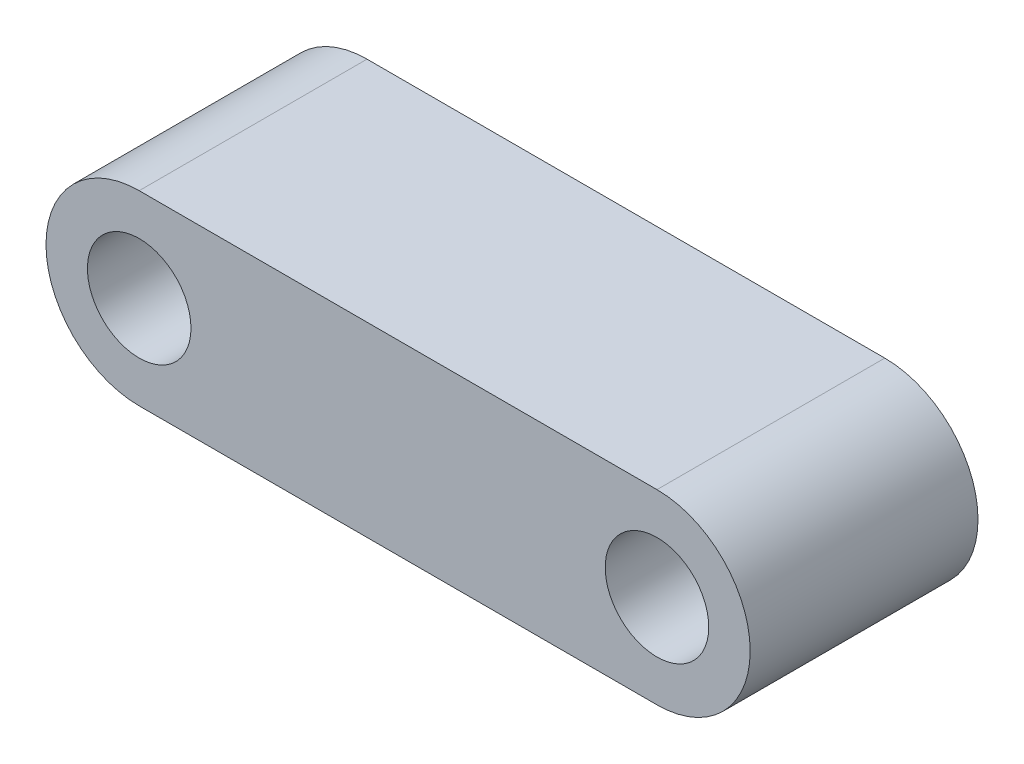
SolidWorks part; units mm, degrees
ref_plane "Alzado" through (0, 0, 0) normal (0, 0, 1) x (1, 0, 0)
ref_plane "Planta" through (0, 0, 0) normal (0, 1, 0) x (1, 0, 0)
ref_plane "Vista lateral" through (0, 0, 0) normal (1, 0, 0) x (0, 0, -1)
sketch "Croquis1" plane through (0, 0, 0) normal (0, 0, 1) x (1, 0, 0)
  line L0 (-12.5, 0) -> (12.5, 0) construction
  line L1 (-12.5, 4.5) -> (12.5, 4.5)
  line L2 (-12.5, -4.5) -> (12.5, -4.5)
  arc A0 (-12.5, 4.5) -> (-12.5, -4.5) centre (-12.5, 0) ccw
  arc A1 (12.5, -4.5) -> (12.5, 4.5) centre (12.5, 0) ccw
  point P2 (0, 0)
  dimension "D1" = 25
  dimension "D2" = 9
extrude "Saliente-Extruir1" add sketch "Croquis1" along normal blind 11
sketch "Croquis2" plane through (0, 0, 11) normal (0, 0, 1) x (1, 0, 0)
  circle A0 centre (-12.5, 0) radius 2.5
  circle A1 centre (12.5, 0) radius 2.5
  dimension "D1" = 5
extrude "Cortar-Extruir1" cut sketch "Croquis2" against normal through all
